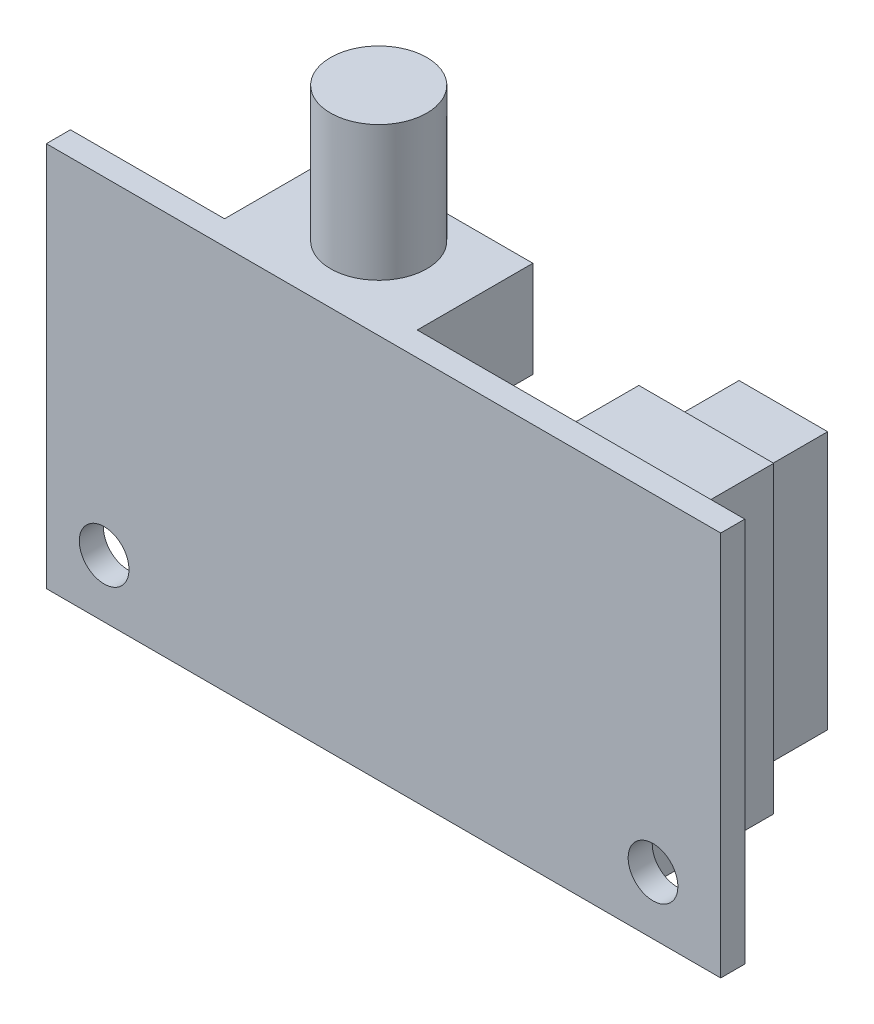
SolidWorks part; units mm, degrees
ref_plane "Front" through (0, 0, 0) normal (0, 0, 1) x (1, 0, 0)
ref_plane "Top" through (0, 0, 0) normal (0, 1, 0) x (1, 0, 0)
ref_plane "Right" through (0, 0, 0) normal (1, 0, 0) x (0, 0, -1)
sketch "Sketch1" plane through (0, 0, 0) normal (0, 0, 1) x (1, 0, 0)
  line L0 (-11.7708, 25.3366) -> (0, 25.3366)
  line L2 (-11.7708, 25.3366) -> (-11.7708, 7.8464)
  line L4 (0, 25.3366) -> (0, 7.8464)
  line L9 (-11.7708, 7.8464) -> (0, 7.8464)
extrude "PCB-Controller" add sketch "Sketch1" against normal blind 1.5875
sketch "Sketch6" plane through (0, 0, 0) normal (0, 0, -1) x (-1, 0, 0)
  line L1 (0, 0) -> (44.45, 0)
  line L2 (0, 0) -> (0, 25.4)
  line L3 (0, 25.4) -> (44.45, 25.4)
  line L4 (44.45, 0) -> (44.45, 25.4)
  dimension "D1" = 25.4
  dimension "D2" = 44.45
extrude "Ref PCB" add sketch "Sketch6" along normal blind 1.5875
sketch "Sketch7" plane through (0, -1.27, 0) normal (0, 0, -1) x (-1, 0, 0)
  line L2 (0, 1.27) -> (44.45, 1.27) construction
  line L3 (44.45, 1.27) -> (44.45, 26.67) construction
  circle A0 centre (4.4639, 5.08) radius 1.6383
  circle A2 centre (40.64, 5.08) radius 1.6383
  dimension "D3" = 3.81
  dimension "D2" = 3.81
extrude "Ref holes" cut sketch "Sketch7" along normal through all
sketch "Sketch9" plane through (0, 0, -1.5875) normal (0, 0, -1) x (-1, 0, 0)
  line L0 (44.45, 25.4) -> (0, 25.4) construction
  line L1 (34.29, 19.05) -> (21.59, 19.05)
  line L2 (34.29, 19.05) -> (34.29, 25.4)
  line L3 (34.29, 25.4) -> (21.59, 25.4)
  line L4 (21.59, 19.05) -> (21.59, 25.4)
  line L5 (44.45, 0) -> (44.45, 25.4) construction
  dimension "D1" = 10.16
  dimension "D2" = 12.7
  dimension "D3" = 6.35
extrude "Extrude7" add sketch "Sketch9" along normal blind 7.62
sketch "Sketch4" plane through (0, 25.4, 0) normal (0, 1, 0) x (-1, 0, 0)
  line L0 (34.29, -9.2075) -> (21.59, -1.5875) construction
  circle A0 centre (27.94, -5.3975) radius 3.175
  dimension "D3" = 6.35
extrude "Extrude8" add sketch "Sketch4" along normal blind 8.89
sketch "Sketch19" plane through (0, 0, -1.5875) normal (0, 0, -1) x (-1, 0, 0)
  line L0 (44.45, 0) -> (44.45, 25.4) construction
  line L1 (0, 0) -> (44.45, 0) construction
  line L8 (7.62, 20.0152) -> (7.62, 0)
  line L9 (7.62, 0) -> (16.51, 0)
  line L10 (16.51, 0) -> (16.51, 20.0152)
  line L11 (16.51, 20.0152) -> (7.62, 20.0152)
  dimension "D1" = 8.89
  dimension "D2" = 20.0152
  dimension "D3" = 27.94
extrude "Extrude15" add sketch "Sketch19" along normal blind 9.525
sketch "Sketch18" plane through (0, 0, -11.1125) normal (0, 0, -1) x (-1, 0, 0)
  line L0 (9.144, 10.0076) -> (7.62, 10.0076) construction
  line L1 (14.986, 18.5166) -> (9.144, 18.5166)
  line L2 (14.986, 18.5166) -> (14.986, 1.4986)
  line L3 (14.986, 1.4986) -> (9.144, 1.4986)
  line L4 (9.144, 18.5166) -> (9.144, 1.4986)
  line L8 (7.62, 20.0152) -> (7.62, 0) construction
  line L10 (12.065, 1.4986) -> (12.065, 0) construction
  line L11 (7.62, 0) -> (16.51, 0) construction
  dimension "D1" = 5.842
  dimension "D2" = 17.018
extrude "Extrude17" add sketch "Sketch18" along normal blind 5.08
